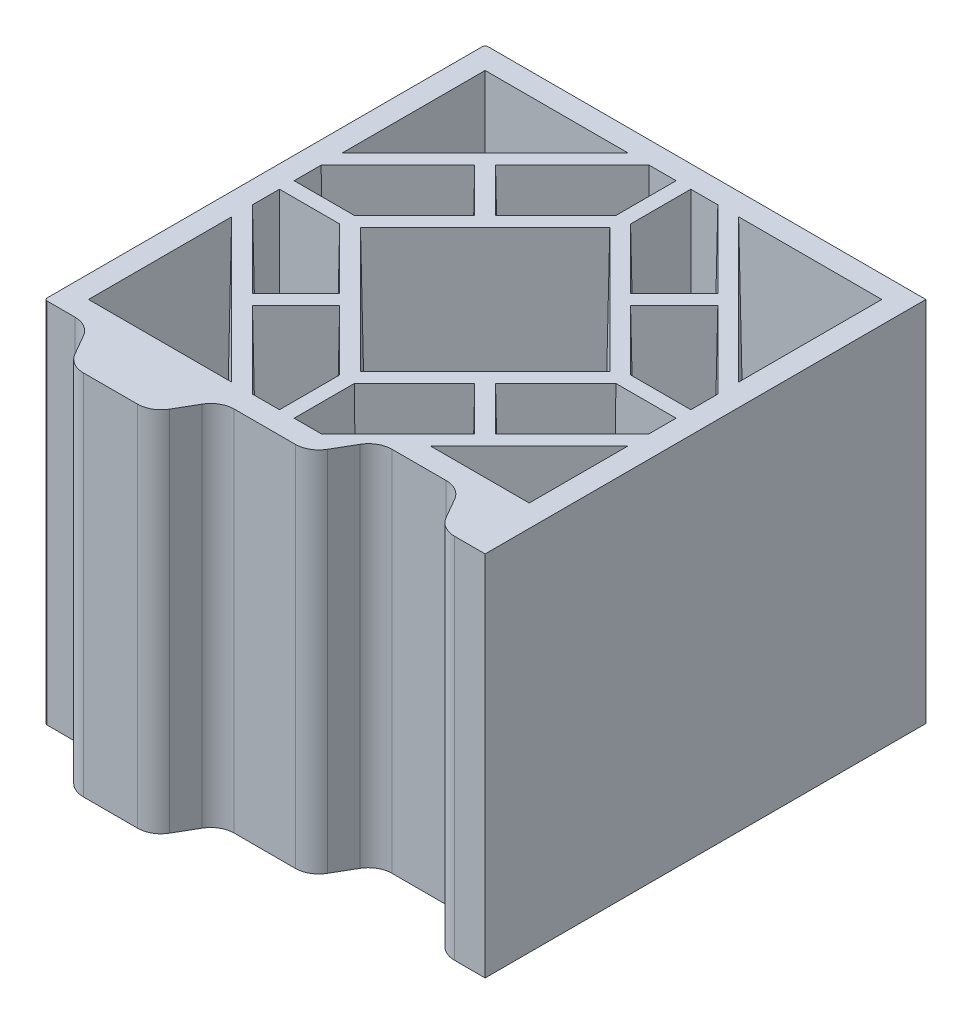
SolidWorks part; units mm, degrees
ref_plane "Face" through (0, 0, 0) normal (0, 0, 1) x (1, 0, 0)
ref_plane "Dessus" through (0, 0, 0) normal (0, 1, 0) x (1, 0, 0)
ref_plane "Droite" through (0, 0, 0) normal (1, 0, 0) x (0, 0, -1)
sketch "Esquisse1" plane through (0, 0, 0) normal (0, 1, 0) x (1, 0, 0)
  line L0 (-27.049, 0) -> (117.5401, 0) construction
  line L1 (0, -19.1048) -> (0, 70.5732) construction
  line L2 (-27.049, 30) -> (117.5401, 30) construction
  line L3 (60, 70.5732) -> (60, -19.1048) construction
  line L4 (30, -16.3807) -> (30, 60.8426) construction
  line L5 (63, 31.7359) -> (63, -10.0742) construction
  line L6 (10.724, -2.2022) -> (11.5377, -0.7978)
  line L7 (5.6558, -3) -> (9.3396, -3)
  line L8 (3.4619, -0.8) -> (4.2702, -2.2)
  line L9 (88.0457, 22.5) -> (78.3175, 22.5) construction
  line L10 (1.5, 1.5) -> (11.246, 1.5)
  line L11 (-1.8986, 15) -> (88.0457, 15) construction
  line L12 (11.246, 1.5) -> (1.5, 11.2466)
  line L13 (1.5, 11.2466) -> (1.5, 1.5)
  line L17 (-11.5642, 28.5) -> (61.6, 28.5) construction
  line L18 (-11.5642, 1.5) -> (61.6, 1.5) construction
  line L19 (0.2, 30) -> (30, 30)
  line L20 (15, 31.2093) -> (15, -16.3807) construction
  line L21 (1.5, -19.1048) -> (1.5, 42.3436) construction
  line L26 (28.5, -2.1548) -> (28.5, 38.6396) construction
  line L27 (3.1884, 35.2969) -> (26.3439, 12.1414) construction
  line L28 (29.1736, 22.5) -> (69.8544, 22.5) construction
  line L29 (29.1736, 21.5) -> (69.8544, 21.5) construction
  line L30 (14.5, 31.2093) -> (14.5, 21.7298) construction
  line L31 (-1.8986, 15.5) -> (8.2765, 15.5) construction
  line L32 (19.276, 2.2022) -> (18.4623, 0.7978)
  line L33 (24.3442, 3) -> (20.6604, 3)
  line L34 (26.5381, 0.8) -> (25.7298, 2.2)
  line L35 (2.0762, 0) -> (0.2, 0)
  line L36 (0, 0.2) -> (0, 29.8)
  line L37 (12.9221, 0) -> (17.0779, 0)
  line L38 (27.9238, 0) -> (30, 0)
  line L39 (4.3977, 14.2972) -> (16.6035, 26.503) construction
  line L40 (30, 30) -> (30, 0)
  line L41 (-0.6211, 7.8642) -> (25.4387, 33.924) construction
  line L44 (-3.5028, 4.5) -> (29.1736, 4.5) construction
  line L49 (0.8207, 16.6599) -> (13.6336, 29.4728) construction
  line L51 (0.7545, 18.0079) -> (12.3559, 29.6093) construction
  line L52 (1.5, 28.5) -> (11.714, 18.286) construction
  line L62 (6.3119, 22.9809) -> (11.1807, 18.1122) construction
  line L66 (1.5, 18.7534) -> (1.5, 28.5)
  line L67 (7.0341, 23.673) -> (12.0676, 18.6395) construction
  line L68 (1.5, 28.5) -> (11.246, 28.5)
  line L69 (11.246, 28.5) -> (1.5, 18.7534)
  line L70 (1.5, 15.5) -> (1.5, 17.3392)
  line L71 (1.5, 17.3392) -> (6.7269, 22.566)
  line L72 (6.7269, 22.566) -> (9.6967, 19.5962)
  line L73 (9.6967, 19.5962) -> (5.6005, 15.5)
  line L81 (5.6005, 15.5) -> (1.5, 15.5)
  line L82 (7.434, 23.2731) -> (10.4038, 20.3033)
  line L83 (10.4038, 20.3033) -> (14.5, 24.3995)
  line L84 (14.5, 24.3995) -> (14.5, 28.5)
  line L85 (14.5, 28.5) -> (12.6608, 28.5)
  line L86 (12.6608, 28.5) -> (7.434, 23.2731)
  line L87 (6.5147, 15) -> (15, 23.4853)
  line L88 (15, 23.4853) -> (23.4853, 15)
  line L89 (23.2731, 22.566) -> (20.3033, 19.5962)
  line L91 (15.5, 24.3995) -> (15.5, 28.5)
  line L92 (15.5, 28.5) -> (17.3392, 28.5)
  line L99 (17.3392, 28.5) -> (22.566, 23.2731)
  line L101 (19.5962, 20.3033) -> (15.5, 24.3995)
  line L102 (22.566, 23.2731) -> (19.5962, 20.3033)
  line L106 (61.6, 7.5) -> (29.1736, 7.5) construction
  line L107 (29.1736, 15.5) -> (69.3515, 15.5) construction
  line L111 (20.3033, 19.5962) -> (24.3995, 15.5)
  line L112 (24.3995, 15.5) -> (28.5, 15.5)
  line L113 (28.5, 15.5) -> (28.5, 17.3392)
  line L114 (28.5, 17.3392) -> (23.2731, 22.566)
  line L115 (28.5, 28.5) -> (18.754, 28.5)
  line L116 (18.754, 28.5) -> (28.5, 18.7534)
  line L117 (28.5, 18.7534) -> (28.5, 28.5)
  line L118 (24.3995, 14.5) -> (28.5, 14.5)
  line L119 (28.5, 14.5) -> (28.5, 12.6608)
  line L120 (28.5, 12.6608) -> (23.2731, 7.434)
  line L121 (20.3033, 10.4038) -> (24.3995, 14.5)
  line L122 (23.2731, 7.434) -> (20.3033, 10.4038)
  line L123 (22.566, 6.7269) -> (19.5962, 9.6967)
  line L124 (28.5, 11.2466) -> (28.5, 4.5)
  line L127 (17.3392, 1.5) -> (22.566, 6.7269)
  line L128 (19.5962, 9.6967) -> (15.5, 5.6005)
  line L129 (15.5, 1.5) -> (17.3392, 1.5)
  line L131 (15.5, 5.6005) -> (15.5, 1.5)
  line L139 (15, 6.5147) -> (23.4853, 15)
  line L140 (6.5147, 15) -> (15, 6.5147)
  line L141 (10.4038, 9.6967) -> (14.5, 5.6005)
  line L143 (14.5, 5.6005) -> (14.5, 1.5)
  line L145 (14.5, 1.5) -> (12.6608, 1.5)
  line L147 (12.6608, 1.5) -> (7.434, 6.7269)
  line L149 (7.434, 6.7269) -> (10.4038, 9.6967)
  line L151 (6.7269, 7.434) -> (9.6967, 10.4038)
  line L153 (9.6967, 10.4038) -> (5.6005, 14.5)
  line L155 (5.6005, 14.5) -> (1.5, 14.5)
  line L157 (1.5, 14.5) -> (1.5, 12.6608)
  line L159 (1.5, 12.6608) -> (6.7269, 7.434)
  line L167 (21.7538, 4.5) -> (28.5, 4.5)
  line L171 (21.7538, 4.5) -> (28.5, 11.2466)
  arc A0 (11.5377, -0.7978) -> (12.9221, 0) centre (12.9221, -1.6) cw
  arc A1 (9.3396, -3) -> (10.724, -2.2022) centre (9.3396, -1.4) ccw
  arc A2 (4.2702, -2.2) -> (5.6558, -3) centre (5.6558, -1.4) ccw
  arc A3 (2.0762, 0) -> (3.4619, -0.8) centre (2.0762, -1.6) cw
  arc A12 (18.4623, 0.7978) -> (17.0779, 0) centre (17.0779, 1.6) cw
  arc A13 (20.6604, 3) -> (19.276, 2.2022) centre (20.6604, 1.4) ccw
  arc A14 (25.7298, 2.2) -> (24.3442, 3) centre (24.3442, 1.4) ccw
  arc A15 (27.9238, 0) -> (26.5381, 0.8) centre (27.9238, 1.6) cw
  arc A16 (0, 29.8) -> (0.2, 30) centre (0.2, 29.8) cw
  arc A17 (0.2, 0) -> (0, 0.2) centre (0.2, 0.2) cw
  circle A20 centre (15, 15) radius 6 construction
  point P122 (0, 30)
  point P125 (0, 0)
  dimension "D13" = 1.5
  dimension "D20" = 3
  dimension "D29" = 0.5
  dimension "D31" = 0.5
  dimension "D32" = 1
  dimension "D28" = 0.5
  dimension "D26" = 4.2
  dimension "D27" = 1
  dimension "D21" = 0.2
  dimension "D19" = 90
  dimension "D1" = 60
  dimension "D2" = 30
  dimension "D3" = 30
  dimension "D4" = 7.5
  dimension "D9" = 15
  dimension "D14" = 1.5
  dimension "D15" = 1.5
  dimension "D16" = 1.5
  dimension "D23" = 15
  dimension "D24" = 45
  dimension "D25" = 1
extrude "Extrusion1" add sketch "Esquisse1" along normal blind 25
draft "Dépouille1" type of draft neutral plane draft angle 1 faces to draft 56 parameters "D1"=1
